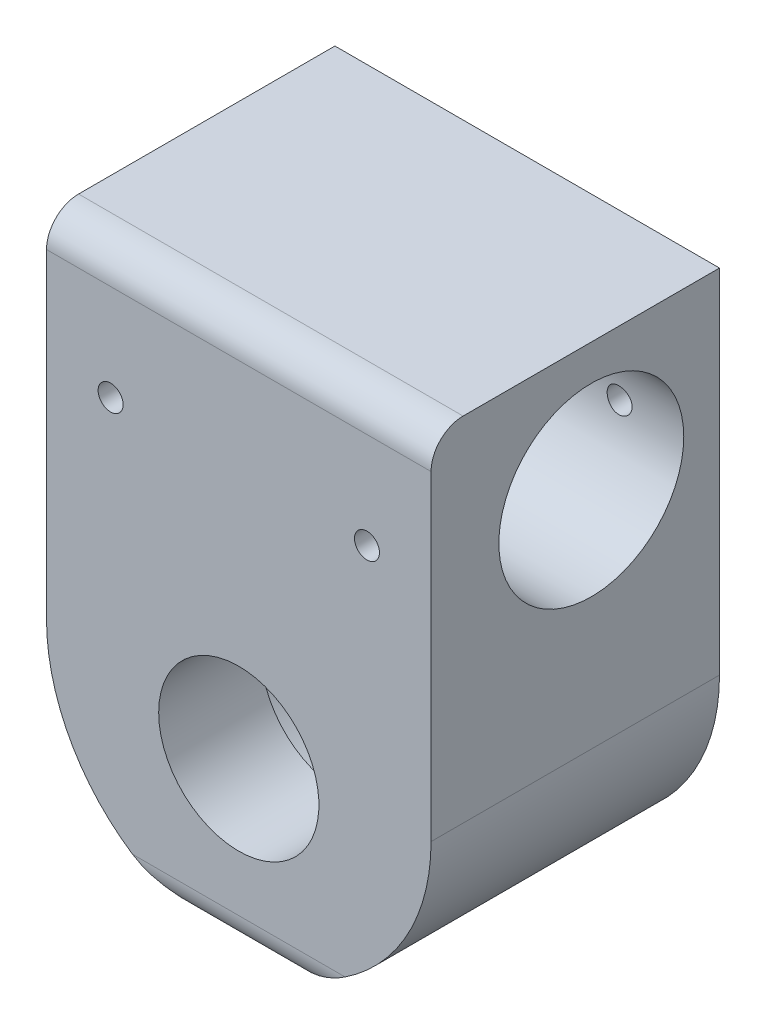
SolidWorks part; units mm, degrees
ref_plane "Front Plane" through (0, 0, 0) normal (0, 0, 1) x (1, 0, 0)
ref_plane "Top Plane" through (0, 0, 0) normal (0, 1, 0) x (1, 0, 0)
ref_plane "Right Plane" through (0, 0, 0) normal (1, 0, 0) x (0, 0, -1)
sketch "Sketch1" plane through (0, 0, 0) normal (0, 0, 1) x (1, 0, 0)
  line L1 (-76.2, -139.7) -> (76.2, -139.7)
  line L2 (-76.2, -139.7) -> (-76.2, 76.2)
  line L3 (-76.2, 76.2) -> (76.2, 76.2)
  line L4 (76.2, -139.7) -> (76.2, 76.2)
  dimension "D1" = 152.4
  dimension "D2" = 215.9
  dimension "D3" = 139.7
  dimension "D4" = 76.2
extrude "Extrude1" add sketch "Sketch1" along normal blind 114.3
sketch "Sketch3" plane through (76.2, 0, 0) normal (1, 0, 0) x (0, 0, -1)
  line L0 (0, -139.7) -> (0, 76.2) construction
  circle A0 centre (-50.8, 25.4) radius 36.6395
  dimension "D1" = 73.279
  dimension "D2" = 25.4
  dimension "D3" = 50.8
extrude "Cut-Extrude1" cut sketch "Sketch3" against normal through all
sketch "Sketch4" plane through (0, 0, 0) normal (0, 0, -1) x (-1, 0, 0)
  line L0 (76.2, 25.4) -> (-76.2, 25.4) construction
  circle A0 centre (0, -73.152) radius 31.75
  dimension "D1" = 63.5
  dimension "D2" = 98.552
extrude "Cut-Extrude2" cut sketch "Sketch4" against normal through all
sketch "Sketch8" plane through (0, 0, 0) normal (0, 0, -1) x (-1, 0, 0)
  circle A0 centre (0, -73.152) radius 55.0545
  dimension "D1" = 110.109
extrude "Cut-Extrude5" cut sketch "Sketch8" against normal blind 73.66
fillet "Fillet1" radius 12.7 1 edges at (0, 76.2, 114.3)
fillet "Fillet2" radius 12.7 1 edges at (0, -139.7, 114.3)
fillet "Fillet4" radius 76.2 2 edges at (-76.2, -139.7, 50.8) (-76.2, -135.9803, 110.5803)
fillet "Fillet5" radius 76.2 4 edges at (76.2, -139.7, 50.8) (76.2, -135.9803, 110.5803) (38.1, -139.7, 101.6) (38.1, -139.7, 0)
sketch "Sketch11" plane through (0, 0, 114.3) normal (0, 0, 1) x (1, 0, 0)
  line L0 (-76.2, 25.4) -> (76.2, 25.4) construction
  circle A0 centre (-50.8, 25.4) radius 4.953
  circle A1 centre (50.8, 25.4) radius 4.953
  dimension "D1" = 9.906
  dimension "D2" = 50.8
  dimension "D3" = 50.8
extrude "Cut-Extrude6" cut sketch "Sketch11" against normal through all
